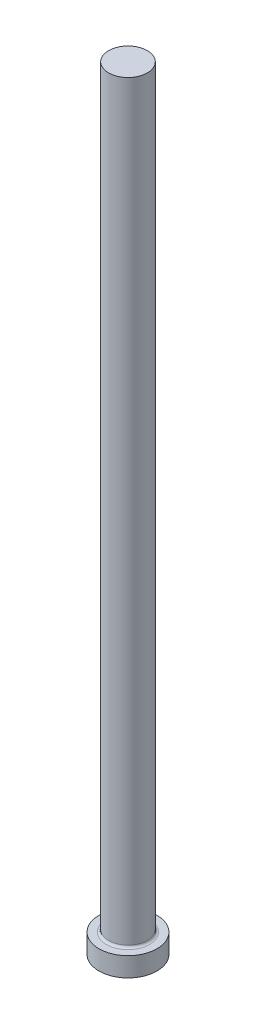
SolidWorks part; units mm, degrees
ref_plane "Front Plane" through (0, 0, 0) normal (0, 0, 1) x (1, 0, 0)
ref_plane "Top Plane" through (0, 0, 0) normal (0, 1, 0) x (1, 0, 0)
ref_plane "Right Plane" through (0, 0, 0) normal (1, 0, 0) x (0, 0, -1)
sketch "Sketch1" plane through (0, 0, 0) normal (0, 0, 1) x (1, 0, 0)
  line L0 (0, 0) -> (9.525, 0)
  line L1 (55, 0) -> (-55, 0) construction
  line L2 (9.525, 0) -> (9.525, 6.35)
  line L3 (9.525, 6.35) -> (7.112, 6.35)
  line L4 (6.35, 7.112) -> (6.35, 254)
  line L5 (6.35, 254) -> (0, 254)
  line L6 (0, 254) -> (0, 0)
  arc A0 (7.112, 6.35) -> (6.35, 7.112) centre (7.112, 7.112) cw
  dimension "D5" = 0.762
  dimension "D1" = 6.35
  dimension "D2" = 9.525
  dimension "D3" = 6.35
  dimension "D4" = 254
revolve "Revolve1" add sketch "Sketch1" angle 360 about L6
